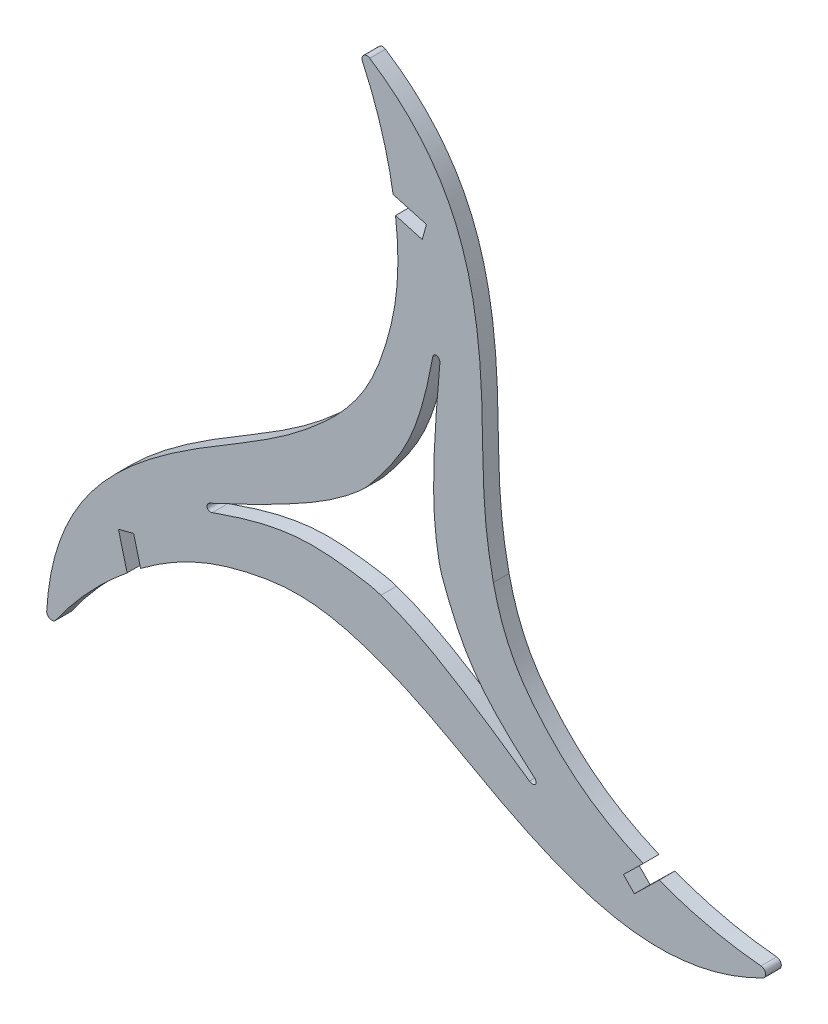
SolidWorks part; units mm, degrees
ref_plane "Ebene vorne" through (0, 0, 0) normal (0, 0, 1) x (1, 0, 0)
ref_plane "Ebene oben" through (0, 0, 0) normal (0, 1, 0) x (1, 0, 0)
ref_plane "Ebene rechts" through (0, 0, 0) normal (1, 0, 0) x (0, 0, -1)
sketch "Skizze1" plane through (0, 0, 0) normal (0, 0, 1) x (1, 0, 0)
  line L0 (2.469, 59.5786) -> (9.2092, 57.6988)
  line L1 (2.9612, 56.1452) -> (8.3563, 54.6405)
  line L2 (9.2092, 57.6988) -> (8.3563, 54.6405)
  line L3 (53.0221, -32.2679) -> (49.0216, -36.1878)
  line L4 (51.2437, -38.4556) -> (56.2417, -33.5584)
  line L5 (49.0216, -36.1878) -> (51.2437, -38.4556)
  line L6 (-53.0458, -26.7813) -> (-51.3036, -33.5584)
  line L7 (-49.9708, -25.9908) -> (-48.5763, -31.4154)
  line L8 (-53.0458, -26.7813) -> (-49.9708, -25.9908)
  line L9 (0, -57.1808) -> (0, 94.6) construction
  line L10 (-79.6227, 0) -> (90.3158, 0) construction
  line L11 (8.3563, 54.6405) -> (-24.2838, -62.3951) construction
  line L12 (49.0216, -36.1878) -> (-26.5411, 40.9291) construction
  line L13 (-49.9708, -25.9908) -> (48.1839, -0.7584) construction
  spline S2 degree 2 poles (2.469, 59.5786) (0.773, 70.1037) (-3.7188, 79.7721) knots 0 0 0 0.834138 0.834138 0.834138 weights 1 0.990551 1
  spline S3 degree 2 poles (-3.7188, 79.7721) (-4.0515, 80.4671) (-3.472, 80.975) knots 0 0 0 0.051907 0.051907 0.051907 weights 1 0.796787 1
  spline S4 degree 2 poles (-3.472, 80.975) (-2.8926, 81.4828) (-2.2473, 81.0618) knots 0 0 0 0.051907 0.051907 0.051907 weights 1 0.796787 1
  spline S5 degree 3 poles (-2.2473, 81.0618) (6.9199, 75.0818) (18.625, 59.5107) (21.0565, 28.9007) (20.3987, 12.3687) (22.7409, 1.7778) knots -24.009903 -24.009903 -24.009903 -24.009903 -23.108209 -22.108209 -21.108209 -21.108209 -21.108209 -21.108209
  spline S6 degree 3 poles (22.7409, 1.7778) (24.8906, -7.9429) (32.1245, -18.2669) (42.7218, -27.6416) (52.1195, -31.8823) (53.0221, -32.2679) knots -21.108209 -21.108209 -21.108209 -21.108209 -20.108209 -19.108209 -19.005693 -19.005693 -19.005693 -19.005693
  spline S10 degree 2 poles (56.2417, -33.5584) (66.2047, -37.3522) (76.8237, -38.2964) knots 0 0 0 0.834138 0.834138 0.834138 weights 1 0.990551 1
  spline S11 degree 2 poles (76.8237, -38.2964) (77.5919, -38.3557) (77.742, -39.1114) knots 0 0 0 0.051907 0.051907 0.051907 weights 1 0.796787 1
  spline S12 degree 2 poles (77.742, -39.1114) (77.8921, -39.8672) (77.2049, -40.2156) knots 0 0 0 0.051907 0.051907 0.051907 weights 1 0.796787 1
  spline S13 degree 3 poles (77.2049, -40.2156) (67.4424, -45.1645) (48.1049, -47.5159) (20.3801, -34.3166) (6.3919, -25.481) (-3.9512, -22.2139) knots -17.614924 -17.614924 -17.614924 -17.614924 -16.71323 -15.71323 -14.71323 -14.71323 -14.71323 -14.71323
  spline S14 degree 3 poles (-3.9512, -22.2139) (-13.4445, -19.2153) (-26.0023, -20.318) (-39.4196, -24.8082) (-47.791, -30.8265) (-48.5763, -31.4154) knots -14.71323 -14.71323 -14.71323 -14.71323 -13.71323 -12.71323 -12.610715 -12.610715 -12.610715 -12.610715
  spline S18 degree 2 poles (-51.3036, -33.5584) (-59.5707, -40.2897) (-65.6979, -49.0139) knots 0 0 0 0.834138 0.834138 0.834138 weights 1 0.990551 1
  spline S19 degree 2 poles (-65.6979, -49.0139) (-66.1333, -49.6495) (-66.8629, -49.4017) knots 0 0 0 0.051907 0.051907 0.051907 weights 1 0.796787 1
  spline S20 degree 2 poles (-66.8629, -49.4017) (-67.5924, -49.1538) (-67.5505, -48.3844) knots 0 0 0 0.051907 0.051907 0.051907 weights 1 0.796787 1
  spline S21 degree 3 poles (-67.5505, -48.3844) (-66.9552, -37.4554) (-59.3229, -19.5329) (-34.0295, -2.1222) (-19.3835, 5.5741) (-11.3826, 12.898) knots -11.219945 -11.219945 -11.219945 -11.219945 -10.318252 -9.318252 -8.318252 -8.318252 -8.318252 -8.318252
  spline S22 degree 3 poles (-11.3826, 12.898) (-4.0391, 19.6201) (1.2849, 31.0468) (4.1049, 44.9116) (3.0786, 55.1706) (2.9612, 56.1452) knots -8.318252 -8.318252 -8.318252 -8.318252 -7.318252 -6.318252 -6.215736 -6.215736 -6.215736 -6.215736
  spline S24 degree 3 poles (-4.3521, 4.2765) (-9.3006, 0.006) (-15.0605, -3.9426) (-34.5449, -12.9674) knots 6.951512 6.951512 6.951512 6.951512 7.552775 7.552775 7.552775 7.552775
  spline S25 degree 5 poles (-34.5449, -12.9674) (-34.682, -13.0309) (-35.7472, -13.5261) (-35.3057, -14.8921) (-34.2291, -14.4356) (-34.0828, -14.3837) knots 0 0 0 0 0 0 1 1 1 1 1 1
  spline S26 degree 3 poles (-34.0828, -14.3837) (-20.0573, -9.4062) (-13.0891, -9.5033) (-1.771, -11.1977) (0, -11.8146) knots 1 1 1 1 1.758966 1.916328 1.916328 1.916328 1.916328
  spline S27 degree 3 poles (0, -11.8146) (6.1726, -13.9649) (12.4721, -16.9788) (30.03, -29.3403) knots 1.916328 1.916328 1.916328 1.916328 2.517592 2.517592 2.517592 2.517592
  spline S28 degree 5 poles (30.03, -29.3403) (30.1536, -29.4274) (31.115, -30.1022) (32.0773, -29.0369) (31.1436, -28.3327) (31.0256, -28.232) knots 2.517592 2.517592 2.517592 2.517592 2.517592 2.517592 3.517592 3.517592 3.517592 3.517592 3.517592 3.517592
  spline S29 degree 3 poles (31.0256, -28.232) (19.7021, -18.5743) (16.3022, -12.4912) (12.1104, -1.8422) (11.7592, 0) knots 3.517592 3.517592 3.517592 3.517592 4.276557 4.43392 4.43392 4.43392 4.43392
  spline S30 degree 3 poles (11.7592, 0) (10.5351, 6.4207) (9.9954, 13.3833) (11.922, 34.7696) knots 4.43392 4.43392 4.43392 4.43392 5.035184 5.035184 5.035184 5.035184
  spline S31 degree 5 poles (11.922, 34.7696) (11.9355, 34.9202) (12.0392, 36.0902) (10.6355, 36.3909) (10.4925, 35.2302) (10.4643, 35.0776) knots 5.035184 5.035184 5.035184 5.035184 5.035184 5.035184 6.035184 6.035184 6.035184 6.035184 6.035184 6.035184
  spline S32 degree 3 poles (10.4643, 35.0776) (7.7622, 20.4424) (4.194, 14.4564) (-2.9323, 5.5017) (-4.3521, 4.2765) knots 6.035184 6.035184 6.035184 6.035184 6.794149 6.951512 6.951512 6.951512 6.951512
extrude "Aufsatz-Linear austragen1" add sketch "Skizze1" along normal mid plane 3.175
ref_plane "Ebene1" through (43.213, -44.1019, 0) normal (-0.6999, 0.7143, 0) x (-0.7143, -0.6999, 0)
ref_plane "Ebene2" through (-54.678, -14.056, 0) normal (0.9685, 0.249, 0) x (0, 0, -1)
ref_plane "Ebene3" through (15.1685, 54.3888, 0) normal (0.2686, 0.9632, 0) x (-0.9632, 0.2686, 0)
